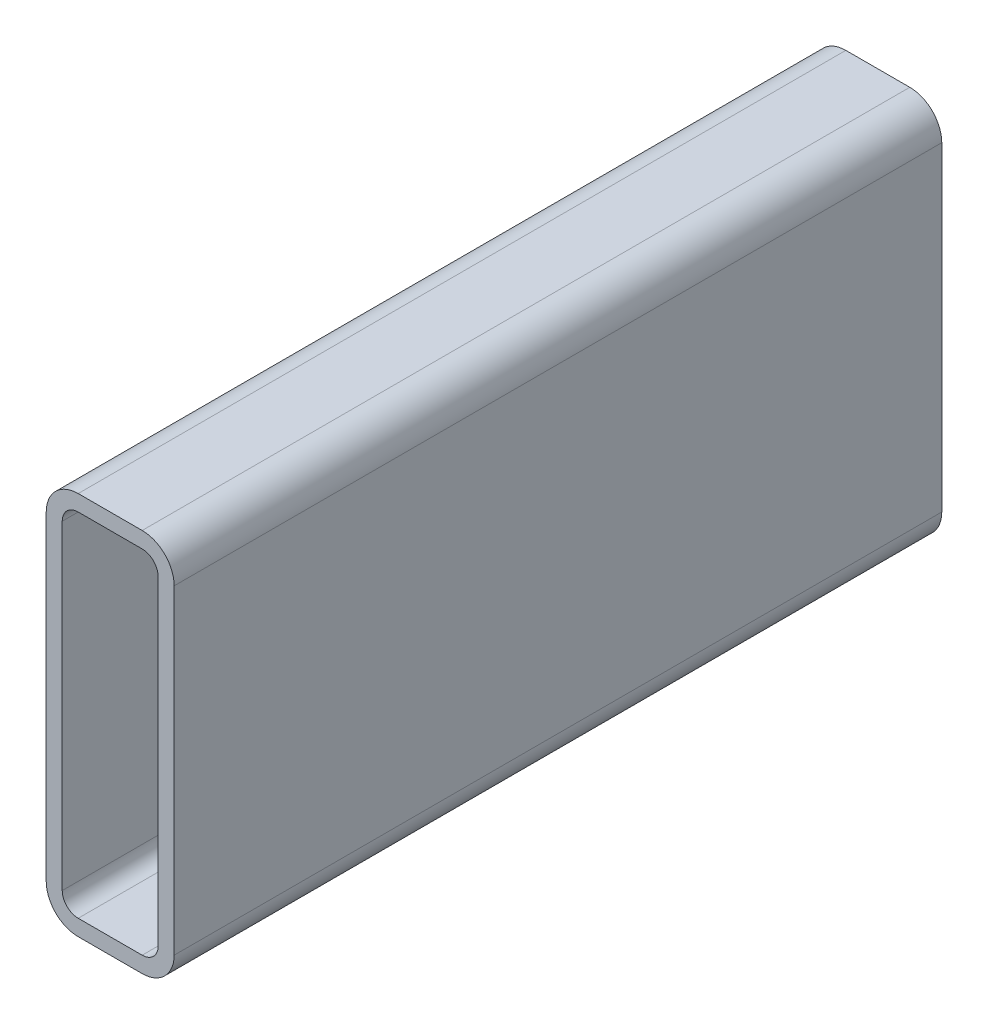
SolidWorks part; units mm, degrees
ref_plane "Front Plane" through (0, 0, 0) normal (0, 0, 1) x (1, 0, 0)
ref_plane "Top Plane" through (0, 0, 0) normal (0, 1, 0) x (1, 0, 0)
ref_plane "Right Plane" through (0, 0, 0) normal (1, 0, 0) x (0, 0, -1)
sketch "Sketch1" plane through (0, 0, 0) normal (0, 0, 1) x (1, 0, 0)
  line B0 (12.7, 152.4) -> (38.1, 152.4)
  arc B1 (50.8, 139.7) -> (38.1, 152.4) centre (38.1, 139.7) ccw
  line B2 (50.8, 139.7) -> (50.8, 12.7)
  arc B3 (38.1, 0) -> (50.8, 12.7) centre (38.1, 12.7) ccw
  line B4 (38.1, 0) -> (12.7, 0)
  arc B5 (0, 12.7) -> (12.7, 0) centre (12.7, 12.7) ccw
  line B6 (0, 12.7) -> (0, 139.7)
  arc B7 (12.7, 152.4) -> (0, 139.7) centre (12.7, 139.7) ccw
  line B8 (12.7, 146.05) -> (38.1, 146.05)
  arc B9 (44.45, 139.7) -> (38.1, 146.05) centre (38.1, 139.7) ccw
  line B10 (44.45, 139.7) -> (44.45, 12.7)
  arc B11 (38.1, 6.35) -> (44.45, 12.7) centre (38.1, 12.7) ccw
  line B12 (38.1, 6.35) -> (12.7, 6.35)
  arc B13 (6.35, 12.7) -> (12.7, 6.35) centre (12.7, 12.7) ccw
  line B14 (6.35, 12.7) -> (6.35, 139.7)
  arc B15 (12.7, 146.05) -> (6.35, 139.7) centre (12.7, 139.7) ccw
sketch_block_instance "HSS6x2x0.250-1"
sketch_block "HSS6x2x0.250"
extrude "Boss-Extrude1" add sketch "Sketch1" along normal blind 304.8
